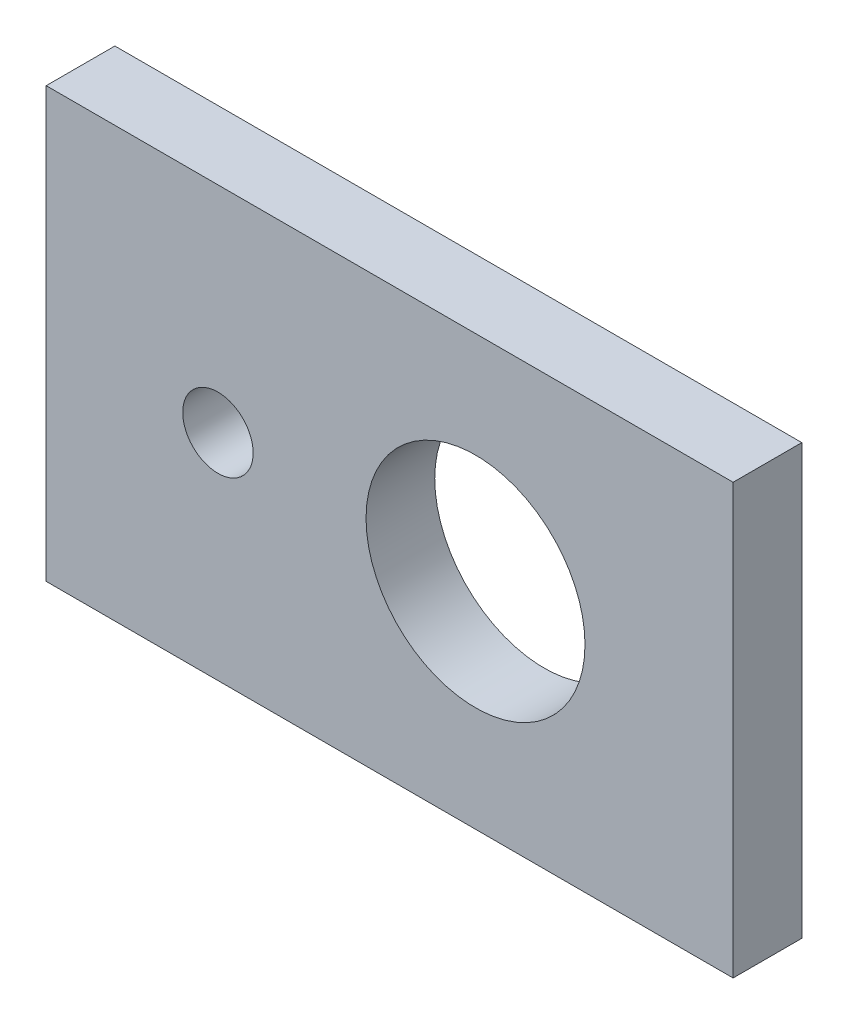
SolidWorks part; units mm, degrees
ref_plane "Face" through (0, 0, 0) normal (0, 0, 1) x (1, 0, 0)
ref_plane "Dessus" through (0, 0, 0) normal (0, 1, 0) x (1, 0, 0)
ref_plane "Droite" through (0, 0, 0) normal (1, 0, 0) x (0, 0, -1)
sketch "Esquisse1" plane through (0, 0, 0) normal (0, 0, 1) x (1, 0, 0)
  line L1 (0, 0) -> (-80, 0)
  line L2 (0, 0) -> (0, 50)
  line L3 (0, 50) -> (-80, 50)
  line L4 (-80, 0) -> (-80, 50)
  circle A0 centre (-30, 25) radius 12.75
  circle A1 centre (-60, 25) radius 4.1
  dimension "D2" = 25.5
  dimension "D3" = 8.2
  dimension "D1" = 30
  dimension "D4" = 30
  dimension "D5" = 80
  dimension "D6" = 50
  dimension "D7" = 25
extrude "Base-Extrusion" add sketch "Esquisse1" along normal blind 8
